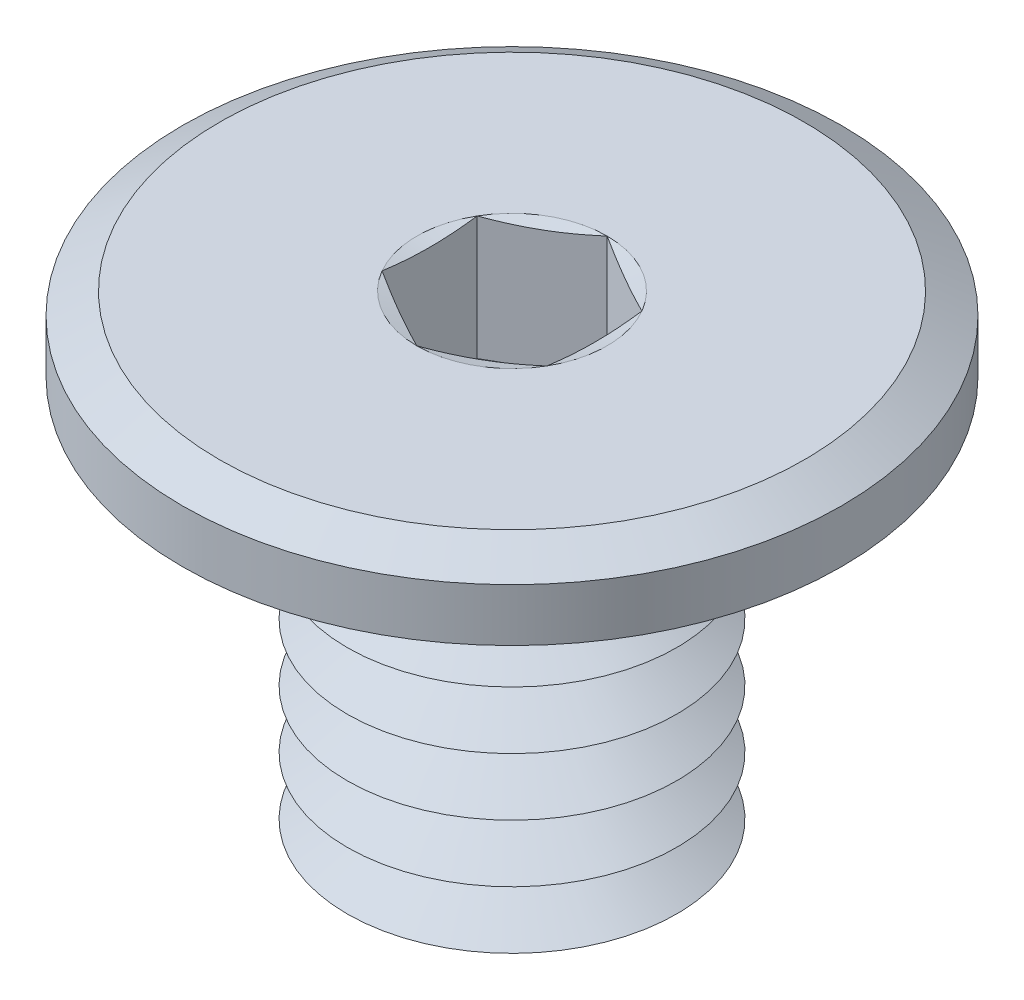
SolidWorks part; units mm, degrees
ref_plane "Front Plane" through (0, 0, 0) normal (0, 0, 1) x (1, 0, 0)
ref_plane "Top Plane" through (0, 0, 0) normal (0, 1, 0) x (1, 0, 0)
ref_plane "Right Plane" through (0, 0, 0) normal (1, 0, 0) x (0, 0, -1)
sketch "Sketch1" plane through (0, 0, 0) normal (0, 1, 0) x (1, 0, 0)
  circle A0 centre (0, 0) radius 4
  dimension "D1" = 8
extrude "Boss-Extrude1" add sketch "Sketch1" against normal blind 0.9
sketch "Sketch2" plane through (0, -0.9, 0) normal (0, -1, 0) x (1, 0, 0)
  circle A0 centre (0, 0) radius 2
  dimension "D1" = 4
extrude "Boss-Extrude2" add sketch "Sketch2" along normal blind 5
sketch "Sketch3" plane through (0, 0, 0) normal (1, 0, 0) x (0, 0, -1)
  line L0 (0, 0.9906) -> (0, -8.2999) construction
sketch "Sketch5" plane through (0, 0, 0) normal (1, 0, 0) x (0, 0, -1)
  line L0 (-2, -6.25) -> (-1.3938, -5.9)
  line L1 (-2, -0.9) -> (-2, -5.9) construction
  line L2 (-1.3938, -5.9) -> (-2, -5.55)
  line L3 (-2, -0.9) -> (-2, -5.9) construction
  line L4 (-2, -5.55) -> (-2, -6.25)
  line L6 (-2, -0.9) -> (-2, -5.9) construction
  line L7 (-2, -0.9) -> (-2, -5.9) construction
  line L14 (-2, -5.9) -> (2, -5.9) construction
  dimension "D1" = 0.7
revolve "Cut-Revolve1" cut sketch "Sketch5" angle 360 about L0
pattern_linear "LPattern1" count 6 spacing 0.7 along (0, 1, 0) of "Cut-Revolve1"
fillet "Fillet1" radius 0.2 1 edges at (0, -0.9, -2)
chamfer "Chamfer2" distance 0.45 angle 30 1 edges at (0, 0, 4)
sketch "Sketch6" plane through (0, 0, 0) normal (0, 1, 0) x (1, 0, 0)
  line L1 (0, 1.1547) -> (-1, 0.5774)
  line L2 (-1, 0.5774) -> (-1, -0.5774)
  line L3 (-1, -0.5774) -> (0, -1.1547)
  line L4 (0, -1.1547) -> (1, -0.5774)
  line L5 (1, -0.5774) -> (1, 0.5774)
  line L6 (1, 0.5774) -> (0, 1.1547)
  circle A0 centre (0, 0) radius 1 construction
  dimension "D1" = 2
extrude "Cut-Extrude1" cut sketch "Sketch6" against normal blind 1.5
sketch "Sketch7" plane through (0, -1.5, 0) normal (0, 1, 0) x (1, 0, 0)
  line L0 (-1, 0.5774) -> (-1, -0.5774) construction
  circle A0 centre (0, 0) radius 1
extrude "Cut-Extrude2" cut sketch "Sketch7" against normal through all draft 60
sketch "Sketch8" plane through (0, 0, 0) normal (0, 1, 0) x (1, 0, 0)
  circle A0 centre (0, 0) radius 1.1547
extrude "Cut-Extrude3" cut sketch "Sketch8" against normal through all draft 75
